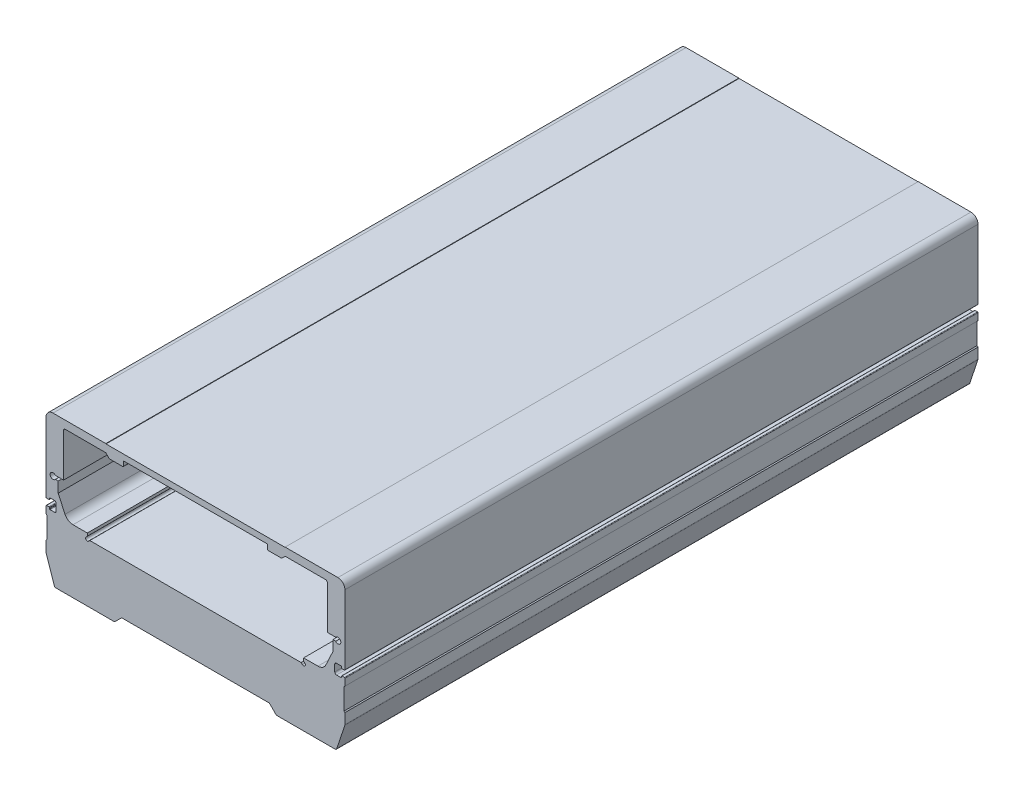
SolidWorks part; units mm, degrees
ref_plane "前视基准面" through (0, 0, 0) normal (0, 0, 1) x (1, 0, 0)
ref_plane "上视基准面" through (0, 0, 0) normal (0, 1, 0) x (1, 0, 0)
ref_plane "右视基准面" through (0, 0, 0) normal (1, 0, 0) x (0, 0, -1)
sketch "草图1" plane through (0, 0, 0) normal (0, 0, 1) x (1, 0, 0)
  line B0 (-85, 77.3) -> (-85, 37.9)
  line B1 (-84.7, 37.6) -> (-83.3, 37.6)
  line B2 (-83, 37.9) -> (-83, 38.4)
  line B3 (-82.7, 38.7) -> (-80.2, 38.7)
  line B4 (-79.2, 37.7) -> (-79.2, 33.9)
  line B5 (-80.2, 32.9) -> (-82.7, 32.9)
  line B6 (-83, 33.2) -> (-83, 33.7)
  line B7 (-83.3, 34) -> (-84.7, 34)
  line B8 (-85, 33.7) -> (-85, 29.8)
  line B9 (-85, 29.8) -> (-84.5, 29.3)
  line B10 (-84.5, 29.3) -> (-84.5, 17.3)
  line B11 (-84.5, 17.3) -> (-85, 16.8)
  line B12 (-85, 16.8) -> (-85, 10.8623)
  line B13 (-84.9487, 10.546) -> (-80.3279, -3.3162)
  line B14 (-79.3792, -4) -> (-46, -4)
  line B15 (-46, -4) -> (-42, 0)
  line B16 (-42, 0) -> (42, 0)
  line B17 (42, 0) -> (46, -4)
  line B18 (46, -4) -> (79.3792, -4)
  line B19 (80.3279, -3.3162) -> (84.9487, 10.546)
  line B20 (85, 10.8623) -> (85, 16.8)
  line B21 (85, 16.8) -> (84.5, 17.3)
  line B22 (84.5, 17.3) -> (84.5, 29.3)
  line B23 (84.5, 29.3) -> (85, 29.8)
  line B24 (85, 29.8) -> (85, 33.7)
  line B25 (84.7, 34) -> (83.3, 34)
  line B26 (83, 33.7) -> (83, 33.2)
  line B27 (82.7, 32.9) -> (80.2, 32.9)
  line B28 (79.2, 33.9) -> (79.2, 37.7)
  line B29 (80.2, 38.7) -> (82.7, 38.7)
  line B30 (83, 38.4) -> (83, 37.9)
  line B31 (83.3, 37.6) -> (84.7, 37.6)
  line B32 (85, 37.9) -> (85, 77.3)
  line B33 (81, 81.3) -> (51, 81.3)
  line B34 (51, 81.3) -> (50.869, 81.169)
  line B35 (50.869, 81.169) -> (-50.869, 81.169)
  line B36 (-50.869, 81.169) -> (-51, 81.3)
  line B37 (-51, 81.3) -> (-81, 81.3)
  line B38 (-41, 77.8) -> (-41, 75.1)
  line B39 (41, 77.8) -> (-41, 77.8)
  line B40 (41, 75.1) -> (41, 77.8)
  line B41 (49, 74.8) -> (41.3, 74.8)
  line B42 (51, 76.8) -> (49, 74.8)
  line B43 (74, 76.8) -> (51, 76.8)
  line B44 (75, 51.3) -> (75, 75.8)
  line B45 (79.6876, 51.3) -> (75, 51.3)
  line B46 (78.1, 49.3) -> (79.6876, 49.3)
  line B47 (78.1, 43.3) -> (78.1, 49.3)
  line B48 (74.1769, 34.8869) -> (78.1, 43.3)
  line B49 (61.5, 32) -> (69.6454, 32)
  line B50 (61.5, 30.4142) -> (61.5, 32)
  line B51 (62.2071, 29.7071) -> (61.5, 30.4142)
  line B52 (60.0858, 29) -> (60.7929, 28.2929)
  line B53 (-60.0858, 29) -> (60.0858, 29)
  line B54 (-60.7929, 28.2929) -> (-60.0858, 29)
  line B55 (-61.5, 30.4142) -> (-62.2071, 29.7071)
  line B56 (-61.5, 32) -> (-61.5, 30.4142)
  line B57 (-69.6454, 32) -> (-61.5, 32)
  line B58 (-78.1, 43.3) -> (-74.1769, 34.8869)
  line B59 (-78.1, 49.3) -> (-78.1, 43.3)
  line B60 (-79.6876, 49.3) -> (-78.1, 49.3)
  line B61 (-75, 51.3) -> (-79.6876, 51.3)
  line B62 (-75, 75.8) -> (-75, 51.3)
  line B63 (-51, 76.8) -> (-74, 76.8)
  line B64 (-49, 74.8) -> (-51, 76.8)
  line B65 (-41.3, 74.8) -> (-49, 74.8)
  arc B66 (-41.3, 74.8) -> (-41, 75.1) centre (-41.3, 75.1) ccw
  arc B67 (41, 75.1) -> (41.3, 74.8) centre (41.3, 75.1) ccw
  arc B68 (-81, 81.3) -> (-85, 77.3) centre (-81, 77.3) ccw
  arc B69 (-85, 37.9) -> (-84.7, 37.6) centre (-84.7, 37.9) ccw
  arc B70 (-83.3, 37.6) -> (-83, 37.9) centre (-83.3, 37.9) ccw
  arc B71 (-82.7, 38.7) -> (-83, 38.4) centre (-82.7, 38.4) ccw
  arc B72 (-79.2, 37.7) -> (-80.2, 38.7) centre (-80.2, 37.7) ccw
  arc B73 (-80.2, 32.9) -> (-79.2, 33.9) centre (-80.2, 33.9) ccw
  arc B74 (-83, 33.2) -> (-82.7, 32.9) centre (-82.7, 33.2) ccw
  arc B75 (-83, 33.7) -> (-83.3, 34) centre (-83.3, 33.7) ccw
  arc B76 (-84.7, 34) -> (-85, 33.7) centre (-84.7, 33.7) ccw
  arc B77 (-85, 10.8623) -> (-84.9487, 10.546) centre (-84, 10.8623) ccw
  arc B78 (-80.3279, -3.3162) -> (-79.3792, -4) centre (-79.3792, -3) ccw
  arc B79 (79.3792, -4) -> (80.3279, -3.3162) centre (79.3792, -3) ccw
  arc B80 (84.9487, 10.546) -> (85, 10.8623) centre (84, 10.8623) ccw
  arc B81 (85, 33.7) -> (84.7, 34) centre (84.7, 33.7) ccw
  arc B82 (83.3, 34) -> (83, 33.7) centre (83.3, 33.7) ccw
  arc B83 (82.7, 32.9) -> (83, 33.2) centre (82.7, 33.2) ccw
  arc B84 (79.2, 33.9) -> (80.2, 32.9) centre (80.2, 33.9) ccw
  arc B85 (80.2, 38.7) -> (79.2, 37.7) centre (80.2, 37.7) ccw
  arc B86 (83, 38.4) -> (82.7, 38.7) centre (82.7, 38.4) ccw
  arc B87 (83, 37.9) -> (83.3, 37.6) centre (83.3, 37.9) ccw
  arc B88 (84.7, 37.6) -> (85, 37.9) centre (84.7, 37.9) ccw
  arc B89 (85, 77.3) -> (81, 81.3) centre (81, 77.3) ccw
  arc B90 (75, 75.8) -> (74, 76.8) centre (74, 75.8) ccw
  arc B91 (79.6876, 49.3) -> (79.6876, 51.3) centre (81, 50.3) ccw
  arc B92 (69.6454, 32) -> (74.1769, 34.8869) centre (69.6454, 37) ccw
  arc B93 (60.7929, 28.2929) -> (62.2071, 29.7071) centre (61.5, 29) ccw
  arc B94 (-62.2071, 29.7071) -> (-60.7929, 28.2929) centre (-61.5, 29) ccw
  arc B95 (-74.1769, 34.8869) -> (-69.6454, 32) centre (-69.6454, 37) ccw
  arc B96 (-79.6876, 51.3) -> (-79.6876, 49.3) centre (-81, 50.3) ccw
  arc B97 (-74, 76.8) -> (-75, 75.8) centre (-74, 75.8) ccw
sketch_block_instance "块2-1"
sketch_block "块2"
extrude "凸台-拉伸1" add sketch "草图1" against normal blind 360
hole_wizard "M8 螺纹孔" positions "草图5" profile "草图6" tap size "M8" standard "GB"
sketch "草图5" plane through (0, -4, 0) normal (0, -1, 0) x (-1, 0, 0)
  line L6 (0, 360) -> (0, 1237.2993) construction
  line L8 (42, 360) -> (-42, 360) construction
  line L9 (79.3792, 360) -> (46, 360) construction
  point P0 (70, 295.5)
  point P2 (-70, 295.5)
  point P12 (70, 245.5)
  point P14 (-70, 245.5)
  point P19 (-70, 45.5)
  point P21 (70, 45.5)
  point P23 (-70, -154.5)
  point P25 (70, -154.5)
  point P27 (-70, -354.5)
  point P29 (70, -354.5)
  point P31 (-70, -554.5)
  point P33 (70, -554.5)
  point P36 (70, -754.5)
  point P38 (-70, -754.5)
  point P52 (-70, -954.5)
  point P54 (70, -954.5)
  dimension "D1" = 64.5
  dimension "D2" = 50
  dimension "D3" = 200
  dimension "D4" = 200
  dimension "D5" = 200
  dimension "D6" = 200
  dimension "D7" = 200
  dimension "D8" = 140
  dimension "D9" = 200
sketch "草图6" plane through (-70, -4, -295.5) normal (1, 0, 0) x (0, 0, -1)
  line L0 (0, 0) -> (0, 21.7929)
  line L1 (0, 21.7929) -> (3.4, 19.75)
  line L2 (3.4, 19.75) -> (3.4, 0)
  line L5 (3.4, 0) -> (0, 0)
  line L10 (0, 21.7929) -> (-3.4, 19.75) construction
  line L11 (0, -6.35) -> (0, 107.95) construction
  dimension "螺纹孔钻头直径" = 6.8
  dimension "螺纹孔钻头深度" = 19.75
  dimension "导头角度" = 118
